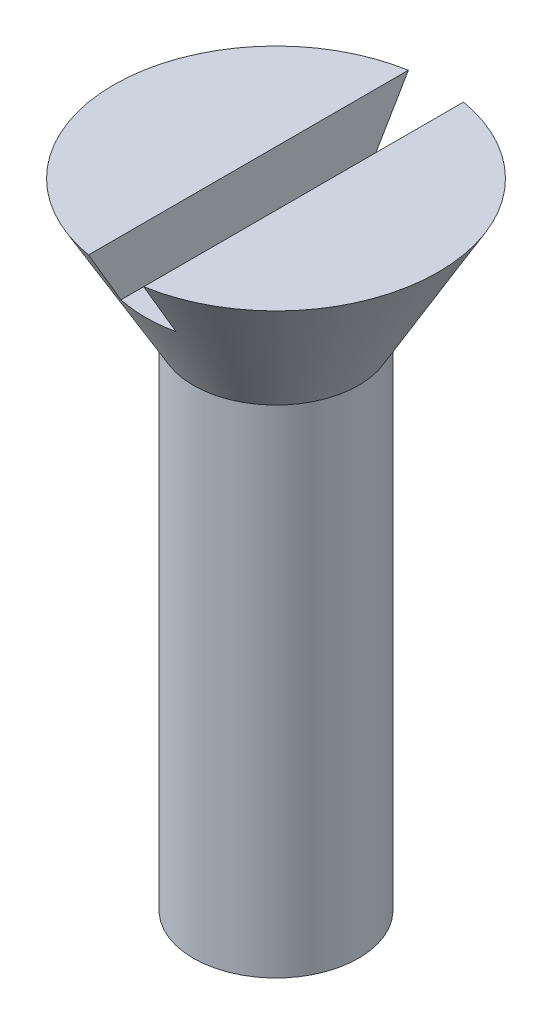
SolidWorks part; units mm, degrees
ref_plane "Front Plane" through (0, 0, 0) normal (0, 0, 1) x (1, 0, 0)
ref_plane "Top Plane" through (0, 0, 0) normal (0, 1, 0) x (1, 0, 0)
ref_plane "Right Plane" through (0, 0, 0) normal (1, 0, 0) x (0, 0, -1)
sketch "Sketch1" plane through (0, 0, 0) normal (0, 0, 1) x (1, 0, 0)
  line L0 (0, 0) -> (0, 24.7321)
  line L1 (0, 24.7321) -> (5.8868, 24.7321)
  line L2 (5.8868, 24.7321) -> (3, 19.7321)
  line L3 (3, 19.7321) -> (3, 1.7321)
  line L4 (3, 1.7321) -> (0, 0)
  line L5 (0, 30.1235) -> (0, -5.1382) construction
  line L7 (-5.8868, 24.7321) -> (-3, 19.7321) construction
  dimension "D1" = 6
  dimension "D2" = 18
  dimension "D3" = 5
  dimension "D4" = 60
  dimension "D5" = 60
revolve "Revolve1" add sketch "Sketch1" angle 360 about L5
sketch "Sketch2" plane through (0, 0, 0) normal (0, 0, 1) x (1, 0, 0)
  line L0 (0, -0.9967) -> (0, 26.645) construction
  line L1 (5.8868, 24.7321) -> (-5.8868, 24.7321) construction
  line L2 (-1, 24.7321) -> (1, 24.7321)
  line L3 (-1, 24.7321) -> (-1, 22.7321)
  line L4 (-1, 22.7321) -> (1, 22.7321)
  line L5 (1, 24.7321) -> (1, 22.7321)
  dimension "D1" = 2
  dimension "D2" = 2
extrude "Cut-Extrude2" cut sketch "Sketch2" against normal mid plane 12
